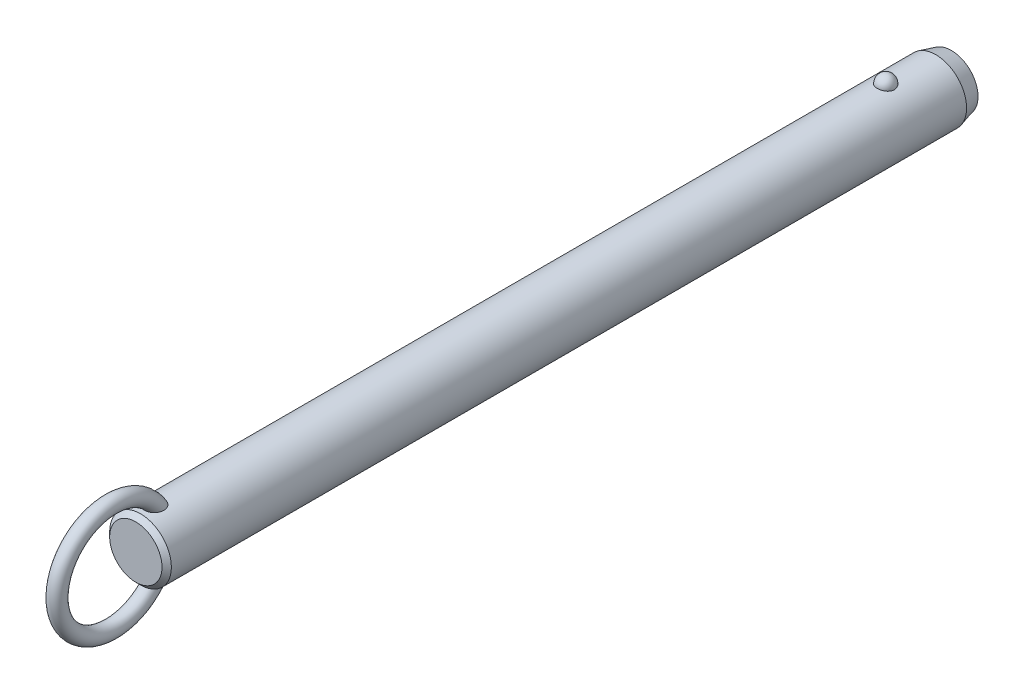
SolidWorks part; units mm, degrees
ref_plane "Front Plane" through (0, 0, 0) normal (0, 0, 1) x (1, 0, 0)
ref_plane "Top Plane" through (0, 0, 0) normal (0, 1, 0) x (1, 0, 0)
ref_plane "Right Plane" through (0, 0, 0) normal (1, 0, 0) x (0, 0, -1)
sketch "Sketch2" plane through (0, 0, 0) normal (0, 0, 1) x (1, 0, 0)
  circle A0 centre (0, 0) radius 7.9
  point P3 (0, 7.9)
  dimension "D1" = 15.8
extrude "Boss-Extrude1" add sketch "Sketch2" along normal blind 180.3
sketch "Sketch3" plane through (0, 0, 0) normal (0, 0, -1) x (-1, 0, 0)
  circle A0 centre (0, 0) radius 7.9
  dimension "D1" = 15.8
extrude "Boss-Extrude2" add sketch "Sketch3" along normal blind 19
chamfer "Chamfer1" distance 4 angle 15 1 edges at (-7.9, 0, -19)
sketch "Sketch12" plane through (0, 0, 0) normal (1, 0, 0) x (0, 0, -1)
  line L0 (-180.3, 7.9) -> (-180.3, -7.9) construction
  point P0 (-180.3, 0)
sketch "Sketch13" plane through (0, 0, 0) normal (1, 0, 0) x (0, 0, -1)
  circle A0 centre (-196.15, 0) radius 15.85
  point P2 (-180.3, 0)
  dimension "D1" = 31.7
sketch "Sketch14" plane through (0, 0, 0) normal (0, 1, 0) x (1, 0, 0)
  circle A0 centre (0, -182.3) radius 2
  point P2 (0, -180.3)
  dimension "D1" = 4
sweep "Sweep1" add profiles "Sketch14" path "Sketch13"
sketch "Sketch15" plane through (0, 0, 180.3) normal (0, 0, 1) x (1, 0, 0)
  circle A0 centre (0, 0) radius 7.9
  dimension "D1" = 15.8
extrude "Boss-Extrude3" add sketch "Sketch15" along normal blind 9.52
chamfer "Chamfer2" distance 1.2 angle 45 1 edges at (7.9, 0, 189.82)
sketch "Sketch18" plane through (0, 0, 0) normal (1, 0, 0) x (0, 0, -1)
  line L0 (15, 7.9) -> (-182.4091, 7.9) construction
  line L1 (2.2, 10.1) -> (2.2, 5.7)
  line L2 (-182.4091, -7.9) -> (15, -7.9) construction
  arc A0 (2.2, 10.1) -> (2.2, 5.7) centre (2.2, 7.9) ccw
  point P4 (0, 7.9)
  dimension "D1" = 18
revolve "Revolve1" add sketch "Sketch18" angle 360 about L1
